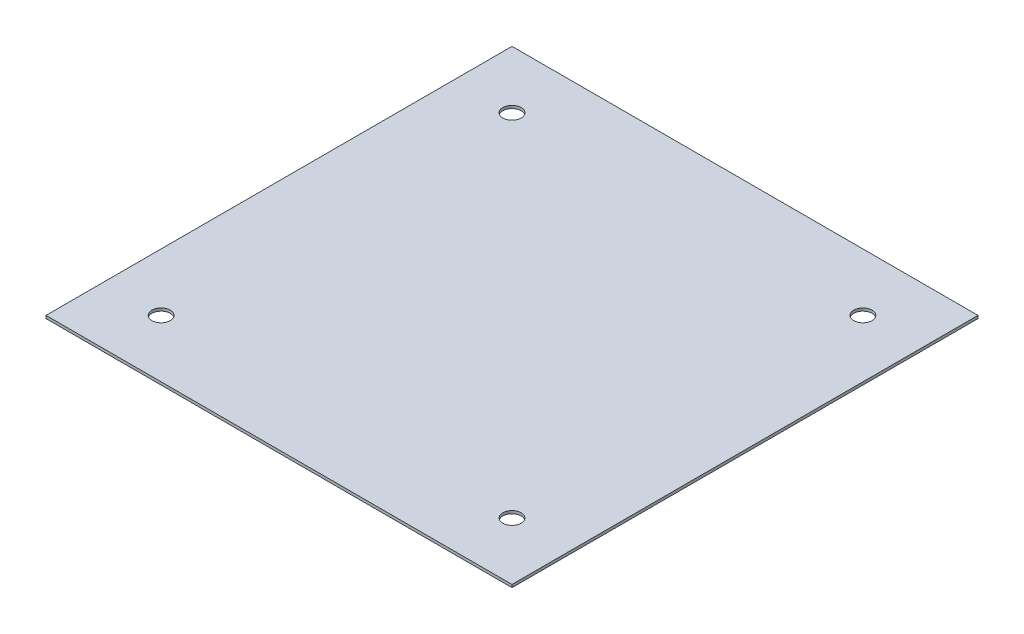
SolidWorks part; units mm, degrees
ref_plane "Front Plane" through (0, 0, 0) normal (0, 0, 1) x (1, 0, 0)
ref_plane "Top Plane" through (0, 0, 0) normal (0, 1, 0) x (1, 0, 0)
ref_plane "Right Plane" through (0, 0, 0) normal (1, 0, 0) x (0, 0, -1)
sketch "Sketch1" plane through (0, 0, 0) normal (0, 1, 0) x (1, 0, 0)
  line L0 (0, -1000) -> (0, 25.5) construction
  line L1 (-166, 166) -> (166, 166)
  line L2 (-166, 166) -> (-166, -166)
  line L3 (-166, -166) -> (166, -166)
  line L4 (166, 166) -> (166, -166)
  line L5 (-166, 166) -> (166, -166) construction
  line L6 (-166, -166) -> (166, 166) construction
  line L7 (-1000, 0) -> (49000, 0) construction
  line L8 (0, 166) -> (0, 49000) construction
  circle A0 centre (-125, 125) radius 6.5
  circle A1 centre (125, 125) radius 6.5
  circle A2 centre (125, -125) radius 6.5
  circle A3 centre (-125, -125) radius 6.5
  point P0 (0, 0)
  point P31 (0, 0)
  dimension "D5" = 13
  dimension "D1" = 332
  dimension "D2" = 41
extrude "Boss-Extrude1" add sketch "Sketch1" along normal blind 2
